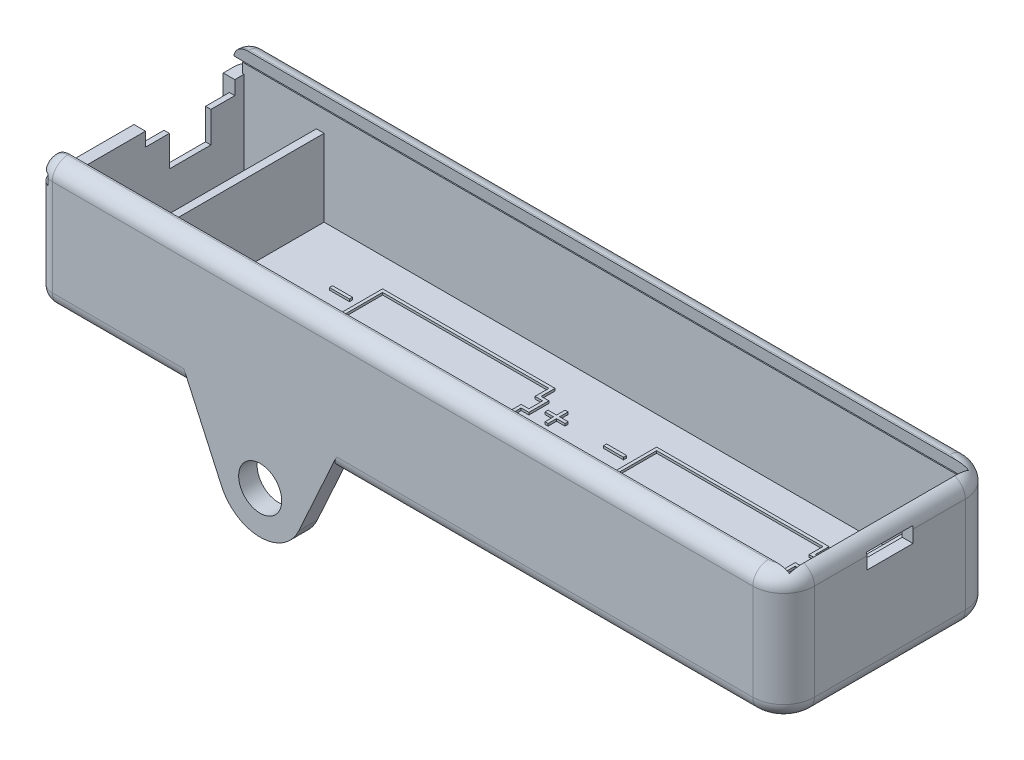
SolidWorks part; units mm, degrees
ref_plane "Front" through (0, 0, 0) normal (0, 0, 1) x (1, 0, 0)
ref_plane "Top" through (0, 0, 0) normal (0, 1, 0) x (1, 0, 0)
ref_plane "Right" through (0, 0, 0) normal (1, 0, 0) x (0, 0, -1)
sketch "Sketch1" plane through (0, 0, 0) normal (0, 1, 0) x (1, 0, 0)
  line L0 (0, 0) -> (123.19, 0)
  line L1 (0, 0) -> (0, 35.052)
  line L2 (123.19, 35.052) -> (0, 35.052)
  line L3 (123.19, 35.052) -> (123.19, 0)
  dimension "Length" = 123.19
  dimension "Width" = 35.052
extrude "Base-Extrude" add sketch "Sketch1" along normal blind 20.955
shell "Shell1" thickness 2.794
sketch "Sketch3" plane through (-30.8976, 18.1349, 0) normal (0, 0, 1) x (1, 0, 0)
  line L1 (30.8976, -18.1349) -> (154.0876, -18.1349) construction
  line L2 (56.2976, -18.1349) -> (79.1576, -18.1349)
  line L3 (30.8976, 2.8201) -> (30.8976, -18.1349) construction
  line L6 (61.3697, -29.2827) -> (56.2976, -18.1349)
  line L7 (74.0854, -29.2827) -> (79.1576, -18.1349)
  line L9 (67.7276, -26.3899) -> (67.7276, -18.7454) construction
  arc A0 (74.0854, -29.2827) -> (61.3697, -29.2827) centre (67.7276, -26.3899) cw
  circle A1 centre (67.7276, -26.3899) radius 3.556
  dimension "D6" = 6.985
  dimension "D3" = 7.112
  dimension "D2" = 25.4
  dimension "D4" = 22.86
  dimension "D1" = 15.24
extrude "Tab" add sketch "Sketch3" against normal blind 3.048
fillet "Fillet1" radius 5.08 2 edges at (123.19, 10.4775, 0) (123.19, 10.4775, -35.052)
fillet "Fillet2" radius 2.54 3 edges at (0, 10.4775, 0) (0, 10.4775, -35.052)
sketch "Sketch16" plane through (0, 0, -3.048) normal (0, 0, -1) x (-1, 0, 0)
  point P0 (-36.83, -8.255)
sketch "Sketch17" plane through (0, 0, 0) normal (0, 0, 1) x (1, 0, 0)
  point P0 (36.83, -8.255)
ref_plane "Plane1" through (36.83, 0, 0) normal (-1, 0, 0) x (0, 0, 1)
sketch "Sketch18" plane through (36.83, 0, 0) normal (-1, 0, 0) x (0, 0, 1)
  line L0 (-3.048, -15.24) -> (-3.048, -11.811) construction
  line L3 (-3.048, -11.811) -> (-1.524, -11.811) construction
  line L4 (-1.524, -11.811) -> (-1.524, -15.24) construction
  line L5 (-3.048, -11.811) -> (-3.048, -12.065)
  line L6 (0, -8.255) -> (-3.048, -8.255) construction
  line L7 (-3.048, -12.065) -> (-1.524, -14.986)
  line L8 (-1.524, -14.986) -> (-1.524, -15.24)
  dimension "D1" = 1.524
  dimension "D2" = 0.254
  dimension "D3" = 0.254
surface "Surface1" sketch "Sketch18" parameters "D1"=360
sketch "Sketch4" plane through (0, 0, -3.048) normal (0, 0, -1) x (-1, 0, 0)
  line L0 (-33.274, -8.255) -> (-33.274, -14.2671) construction
  line L1 (-40.386, -8.255) -> (-40.386, -14.2671) construction
  line L2 (-40.132, -14.4102) -> (-40.132, -9.5748)
  line L3 (-33.528, -14.4102) -> (-33.528, -9.5748)
  circle A0 centre (-36.83, -8.255) radius 3.556 construction
  arc A1 (-43.1878, -11.1478) -> (-30.4722, -11.1478) centre (-36.83, -8.255) ccw construction
  arc A2 (-40.132, -9.5748) -> (-33.528, -9.5748) centre (-36.83, -8.255) ccw
  arc A3 (-40.132, -14.4102) -> (-33.528, -14.4102) centre (-36.83, -8.255) ccw
  dimension "D1" = 0.254
  dimension "D2" = 0.254
extrude "Snap bevel" cut sketch "Sketch4" against normal up to surface (1.524 mm away)
ref_plane "Mirror Plane" through (0, 0, -17.526) normal (0, 0, -1) x (-1, 0, 0)
mirror "Mirror8" about plane through (0, 0, -17.526) normal (0, 0, -1) of "Tab"
mirror "Mirror9" about plane through (0, 0, -17.526) normal (0, 0, -1) of "Snap bevel"
fillet "Fillet4" radius 2.54 5 edges at (123.19, 0, -17.526) (83.185, 0, -35.052) (121.7021, 0, -33.5641) (121.7021, 0, -1.4879)
fillet "Fillet6" radius 2.54 5 edges at (0, 0, -17.526) (0.7439, 0, -34.3081) (0.7439, 0, -0.7439) (13.97, 0, -35.052)
sketch "Sketch19" plane through (0.6366, 0, 0.629) normal (0, -1, 0) x (1, 0, 0)
  line L2 (-38.7052, -18.155) -> (37.432, -18.155) construction
  line L3 (-0.6366, -3.169) -> (-0.6366, -33.141) construction
  circle A0 centre (13.9684, -18.155) radius 9.271
  circle A1 centre (13.9684, -18.155) radius 8.001
  dimension "D1" = 18.542
  dimension "D2" = 16.002
  dimension "D4" = 14.605
extrude "Spring retainer" add sketch "Sketch19" along normal blind 1.778
fillet "Fillet8" radius 2.54 9 edges at (1.905, 20.955, -17.526) (123.19, 20.955, -17.526) (60.325, 20.955, -35.052) (121.7021, 20.955, -33.5641) (121.7021, 20.955, -1.4879) (60.325, 20.955, 0) (0, 20.955, -17.526) (0.7439, 20.955, -34.3081) (0.7439, 20.955, -0.7439)
sketch "Sketch20" plane through (1.905, 0, 0) normal (1, 0, 0) x (0, 0, -1)
  line L0 (26.797, 15.0323) -> (30.734, 15.0323)
  line L2 (2.794, 17.3183) -> (16.002, 17.3183)
  line L3 (26.797, 15.0323) -> (26.797, 9.9523)
  line L4 (2.794, 20.8743) -> (2.794, 2.794)
  line L5 (2.794, 2.794) -> (32.258, 2.794)
  line L6 (32.258, 2.794) -> (32.258, 20.8743)
  line L7 (32.258, 20.8743) -> (2.794, 20.8743)
  line L8 (2.794, 20.8743) -> (2.794, 17.3183)
  line L9 (19.939, 9.9523) -> (26.797, 9.9523)
  line L10 (32.258, 17.3183) -> (32.258, 20.8743)
  line L11 (32.258, 20.8743) -> (2.794, 20.8743)
  line L12 (19.939, 9.9523) -> (19.939, 15.0323)
  line L13 (30.734, 17.3183) -> (32.258, 17.3183)
  line L14 (30.734, 17.3183) -> (30.734, 15.0323)
  line L15 (16.002, 15.0323) -> (19.939, 15.0323)
  line L16 (16.002, 15.0323) -> (16.002, 17.3183)
  dimension "D3" = 6.858
  dimension "D4" = 14.732
  dimension "D5" = 5.08
  dimension "D2" = 3.556
  dimension "D6" = 13.208
  dimension "D7" = 1.524
  dimension "D8" = 2.286
  dimension "D1" = 0
extrude "Switch cut-out" cut sketch "Sketch20" against normal through all
sketch "Sketch21" plane through (0, 0, 0) normal (-1, 0, 0) x (0, 0, 1)
  line L0 (-35.052, 18.923) -> (0, 18.923)
  line L1 (-35.052, 18.923) -> (-35.052, 17.3183)
  line L2 (0, 17.3183) -> (-35.052, 17.3183)
  line L3 (0, 17.3183) -> (0, 18.923)
  line L4 (-2.794, 17.3183) -> (-16.002, 17.3183) construction
  line L5 (0, 18.415) -> (0, 2.54) construction
  line L6 (-35.052, 2.54) -> (-35.052, 18.415) construction
  line L7 (-31.0792, 20.955) -> (-3.9728, 20.955) construction
  dimension "D1" = 1.6047
  dimension "D2" = 2.032
extrude "Cut-Extrude3" cut sketch "Sketch21" against normal blind 1.651
sketch "Sketch22" plane through (0, 0, 0) normal (-1, 0, 0) x (0, 0, 1)
  line L0 (-30.734, 15.0323) -> (-16.002, 15.0323)
  line L1 (-30.734, 15.0323) -> (-30.734, 6.1423)
  line L2 (-16.002, 6.1423) -> (-30.734, 6.1423)
  line L3 (-16.002, 6.1423) -> (-16.002, 15.0323)
  line L4 (-16.002, 15.0323) -> (-16.002, 17.3183) construction
  dimension "D1" = 8.89
extrude "On-Off recess" cut sketch "Sketch22" against normal blind 1.016
sketch "Sketch23" plane through (0, 0, -35.052) normal (0, 0, -1) x (-1, 0, 0)
  line L0 (0, 17.3183) -> (0, 2.54) construction
  line L1 (-118.11, 20.955) -> (-2.54, 20.955) construction
  circle A1 centre (-12.065, 8.89) radius 2.8575
  dimension "D2" = 5.715
  dimension "D3" = 12.065
  dimension "D4" = 12.065
extrude "Wire hole" cut sketch "Sketch23" against normal up to next
sketch "Sketch25" plane through (0, 2.794, 0) normal (0, 1, 0) x (-1, 0, 0)
  line L0 (-13.843, -32.258) -> (-13.843, -4.572)
  line L1 (-119.2172, -32.258) -> (-2.54, -32.258) construction
  line L2 (-1.905, -2.794) -> (-1.905, -16.002) construction
  dimension "D1" = 11.938
  dimension "D2" = 27.686
extrude "Battery divider" add sketch "Sketch25" along normal blind 12.7 thin
sketch "Sketch26" plane through (0, 0, -35.052) normal (0, 0, -1) x (-1, 0, 0)
  circle A0 centre (-12.065, 8.89) radius 2.8575 construction
  circle A1 centre (-12.065, 8.89) radius 4.1275
  circle A2 centre (-12.065, 8.89) radius 4.1275
  circle A3 centre (-12.065, 8.89) radius 2.8575
  dimension "D1" = 1.27
extrude "Arm pivot" add sketch "Sketch26" along normal blind 4.318
sketch "Sketch27" plane through (0, 0, -39.37) normal (0, 0, -1) x (-1, 0, 0)
  circle A0 centre (-12.065, 8.89) radius 2.8575 construction
  circle A1 centre (-12.065, 8.89) radius 5.3975
  circle A2 centre (-12.065, 8.89) radius 5.3975
  circle A3 centre (-12.065, 8.89) radius 2.8575
  dimension "D1" = 1.27
extrude "Arm snap collar" add sketch "Sketch27" along normal blind 1.778
chamfer "Chamfer2" distance 1.27 angle 45 1 edges at (6.6675, 8.89, -41.148)
sketch "Sketch28" plane through (0, 0, -41.148) normal (0, 0, -1) x (-1, 0, 0)
  line L0 (-17.425, 9.525) -> (-6.705, 9.525)
  line L2 (-6.705, 8.255) -> (-17.425, 8.255)
  circle A0 centre (-12.065, 8.89) radius 5.3975 construction
  arc A1 (-17.425, 9.525) -> (-17.425, 8.255) centre (-12.065, 8.89) ccw
  arc A2 (-6.705, 8.255) -> (-6.705, 9.525) centre (-12.065, 8.89) ccw
  dimension "D1" = 1.27
extrude "Snap collar relief" cut sketch "Sketch28" against normal offset from surface (4.826 mm away) 1.27
sketch "Sketch29" plane through (0, 0, -35.052) normal (0, 0, -1) x (-1, 0, 0)
  line L0 (-19.9961, 2.54) -> (-4.1339, 2.54)
  line L1 (-24.2443, 2.54) -> (-2.54, 2.54) construction
  arc A0 (-19.9961, 2.54) -> (-4.1339, 2.54) centre (-12.065, 8.89) ccw
  dimension "D1" = 20.32
extrude "Arm backing plate" add sketch "Sketch29" against normal blind 2.032
sketch "Sketch30" plane through (0, 20.955, 0) normal (0, 1, 0) x (-1, 0, 0)
  line L0 (-120.396, -32.258) -> (-121.412, -32.258)
  line L1 (-120.396, -32.258) -> (-120.396, -2.794)
  line L2 (-121.412, -2.794) -> (-120.396, -2.794)
  line L3 (-121.412, -2.794) -> (-121.412, -32.258)
  line L4 (-2.54, -2.794) -> (-119.2172, -2.794) construction
  line L5 (-123.19, -29.972) -> (-123.19, -5.08) construction
  line L7 (-120.396, -32.258) -> (-120.396, -2.794) construction
  line L8 (-119.2172, -32.258) -> (-2.54, -32.258) construction
  dimension "D1" = 1.778
  dimension "D2" = 1.016
extrude "Cut-Extrude4" cut sketch "Sketch30" against normal blind 5.08
sketch "Sketch31" plane through (121.412, 0, 0) normal (-1, 0, 0) x (0, 0, 1)
  line L0 (-21.336, 16.383) -> (-13.716, 16.383)
  line L1 (-21.336, 16.383) -> (-21.336, 18.923)
  line L2 (-13.716, 18.923) -> (-21.336, 18.923)
  line L3 (-13.716, 18.923) -> (-13.716, 16.383)
  line L7 (-2.794, 20.955) -> (-32.258, 20.955) construction
  line L8 (-2.794, 15.875) -> (-32.258, 15.875) construction
  point P6 (-17.526, 18.923)
  point P8 (-17.526, 15.875)
  dimension "D1" = 2.54
  dimension "D2" = 7.62
  dimension "D3" = 2.032
extrude "Cut-Extrude5" cut sketch "Sketch31" against normal through all
sketch "Sketch33" plane through (0, 0, 0) normal (-1, 0, 0) x (0, 0, 1)
  line L0 (-2.794, 20.955) -> (-2.794, 18.923) construction
  line L1 (-2.794, 20.955) -> (-2.794, 18.923)
  line L2 (-2.794, 18.923) -> (-2.6162, 18.923)
  line L3 (-2.6162, 18.923) -> (-2.794, 20.955)
  dimension "D1" = 2.032
  dimension "D2" = 5
extrude "Cover groove1" cut sketch "Sketch33" against normal up to surface (121.412 mm away)
mirror "Mirror10" about plane through (0, 0, -17.526) normal (0, 0, -1) of "Cover groove1"
sketch "Sketch35" plane through (37.0512, 2.794, -25.1154) normal (0, 1, 0) x (-1, 0, 0)
  line L0 (-23.7818, 2.1284) -> (-25.1788, 2.1284)
  line L1 (-23.7818, 2.1284) -> (-23.7818, 1.6204)
  line L2 (-27.0838, 1.6204) -> (-25.6868, 1.6204)
  line L3 (-27.0838, 1.6204) -> (-27.0838, 2.1284)
  line L4 (-25.1788, 0.2234) -> (-25.6868, 0.2234)
  line L5 (-25.1788, 0.2234) -> (-25.1788, 1.6204)
  line L6 (-25.6868, 3.5254) -> (-25.1788, 3.5254)
  line L7 (-25.6868, 3.5254) -> (-25.6868, 2.1284)
  line L8 (-25.1788, 1.6204) -> (-23.7818, 1.6204)
  line L9 (-25.1788, 2.1284) -> (-25.1788, 3.5254)
  line L10 (-25.6868, 2.1284) -> (-27.0838, 2.1284)
  line L11 (-25.6868, 1.6204) -> (-25.6868, 0.2234)
  line L12 (-82.166, -7.1426) -> (34.5112, -7.1426) construction
  line L13 (11.7782, 2.1284) -> (8.4762, 2.1284)
  line L14 (11.7782, 2.1284) -> (11.7782, 1.6204)
  line L15 (8.4762, 1.6204) -> (11.7782, 1.6204)
  line L16 (8.4762, 1.6204) -> (8.4762, 2.1284)
  line L17 (21.9382, -7.1426) -> (21.9382, 20.5434) construction
  line L18 (7.2062, -2.0626) -> (-21.2418, -2.0626)
  line L19 (7.2062, -2.0626) -> (7.2062, 5.8114)
  line L20 (-21.2418, 5.8114) -> (7.2062, 5.8114)
  line L21 (-21.2418, 5.8114) -> (-21.2418, 3.5254)
  line L22 (-21.2418, 3.5254) -> (-22.5118, 3.5254)
  line L23 (-21.2418, 0.2234) -> (-21.2418, -2.0626)
  line L24 (-22.5118, 0.2234) -> (-21.2418, 0.2234)
  line L25 (-22.5118, 0.2234) -> (-22.5118, 3.5254)
  line L26 (6.6982, 5.3034) -> (-20.7338, 5.3034)
  line L27 (6.6982, 5.3034) -> (6.6982, -1.5546)
  line L28 (-20.7338, -1.5546) -> (6.6982, -1.5546)
  line L29 (-20.7338, -1.5546) -> (-20.7338, 0.7314)
  line L30 (-20.7338, 0.7314) -> (-22.0038, 0.7314)
  line L31 (-20.7338, 3.0174) -> (-20.7338, 5.3034)
  line L32 (-22.0038, 3.0174) -> (-20.7338, 3.0174)
  line L33 (-22.0038, 3.0174) -> (-22.0038, 0.7314)
  dimension "D1" = 7.874
  dimension "thickness" = 0.508
  dimension "D2" = 1.27
  dimension "D3" = 28.448
  dimension "D4" = 1.27
  dimension "D5" = 1.27
  dimension "D6" = 3.302
  dimension "D7" = 3.302
  dimension "D8" = 5.08
  dimension "D9" = 14.732
extrude "Boss-Extrude2" add sketch "Sketch35" along normal blind 0.381
sketch "Sketch36" plane through (46.1641, 2.794, -11.731) normal (0, -1, 0) x (1, 0, 0)
  line L0 (-17.5891, 0.174) -> (-18.9861, 0.174)
  line L1 (-17.5891, 0.174) -> (-17.5891, -0.334)
  line L2 (-20.8911, -0.334) -> (-19.4941, -0.334)
  line L3 (-20.8911, -0.334) -> (-20.8911, 0.174)
  line L4 (-18.9861, -1.731) -> (-19.4941, -1.731)
  line L5 (-18.9861, -1.731) -> (-18.9861, -0.334)
  line L6 (-19.4941, 1.571) -> (-18.9861, 1.571)
  line L7 (-19.4941, 1.571) -> (-19.4941, 0.174)
  line L8 (-18.9861, -0.334) -> (-17.5891, -0.334)
  line L9 (-18.9861, 0.174) -> (-18.9861, 1.571)
  line L10 (-19.4941, 0.174) -> (-20.8911, 0.174)
  line L11 (-19.4941, -0.334) -> (-19.4941, -1.731)
  line L12 (-16.3191, -15.447) -> (-16.3191, -7.573) construction
  line L13 (17.9709, 0.174) -> (14.6689, 0.174)
  line L14 (17.9709, 0.174) -> (17.9709, -0.334)
  line L15 (14.6689, -0.334) -> (17.9709, -0.334)
  line L16 (14.6689, -0.334) -> (14.6689, 0.174)
  line L17 (-43.6241, 8.937) -> (73.0531, 8.937) construction
  line L18 (13.3989, -4.017) -> (-15.0491, -4.017)
  line L19 (13.3989, -4.017) -> (13.3989, 3.857)
  line L20 (-15.0491, 3.857) -> (13.3989, 3.857)
  line L21 (-15.0491, 3.857) -> (-15.0491, 1.571)
  line L22 (-15.0491, 1.571) -> (-16.3191, 1.571)
  line L23 (-15.0491, -1.731) -> (-15.0491, -4.017)
  line L24 (-16.3191, -1.731) -> (-15.0491, -1.731)
  line L25 (-16.3191, -1.731) -> (-16.3191, 1.571)
  line L26 (12.8909, 3.349) -> (-14.5411, 3.349)
  line L27 (12.8909, 3.349) -> (12.8909, -3.509)
  line L28 (-14.5411, -3.509) -> (12.8909, -3.509)
  line L29 (-14.5411, -3.509) -> (-14.5411, -1.223)
  line L30 (-14.5411, -1.223) -> (-15.8111, -1.223)
  line L31 (-14.5411, 1.063) -> (-14.5411, 3.349)
  line L32 (-15.8111, 1.063) -> (-14.5411, 1.063)
  line L33 (-15.8111, 1.063) -> (-15.8111, -1.223)
  dimension "D1" = 7.874
  dimension "thickness" = 0.508
  dimension "D2" = 1.27
  dimension "D3" = 28.448
  dimension "D4" = 1.27
  dimension "D5" = 1.27
  dimension "D6" = 3.302
  dimension "D7" = 3.302
  dimension "D8" = 5.08
extrude "Boss-Extrude3" add sketch "Sketch36" against normal blind 0.381
pattern_linear "LPattern1" count 2 spacing 45.212 along (1, 0, 0) of "Boss-Extrude3", "Boss-Extrude2"
